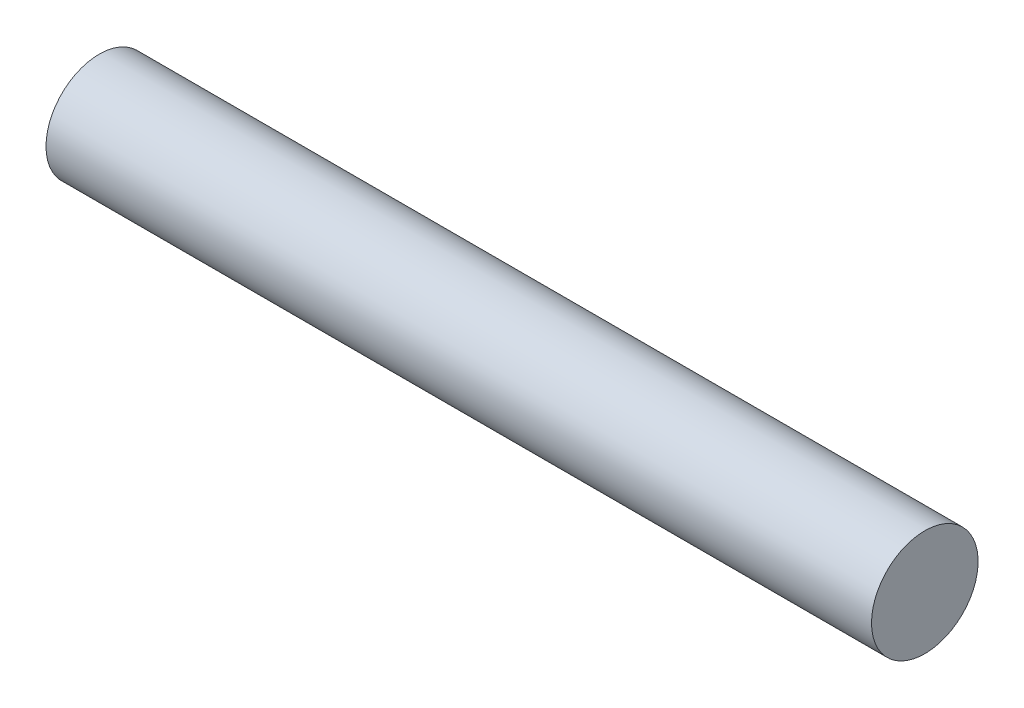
SolidWorks part; units mm, degrees
ref_plane "Ebene vorne" through (0, 0, 0) normal (0, 0, 1) x (1, 0, 0)
ref_plane "Ebene oben" through (0, 0, 0) normal (0, 1, 0) x (1, 0, 0)
ref_plane "Ebene rechts" through (0, 0, 0) normal (1, 0, 0) x (0, 0, -1)
sketch "Skizze1" plane through (0, 0, 0) normal (0, 0, 1) x (1, 0, 0)
  line L0 (-89.0088, 0) -> (89.0088, 0) construction
  line L1 (71.5528, 0) -> (-60.4243, 0)
  line L3 (-60.4243, 0) -> (-60.4243, -8.5203)
  line L4 (-60.4243, -8.5203) -> (71.5528, -8.5203)
  line L5 (71.5528, 0) -> (71.5528, -8.5203)
revolve "Rotation1" add sketch "Skizze1" angle 360 about L0
